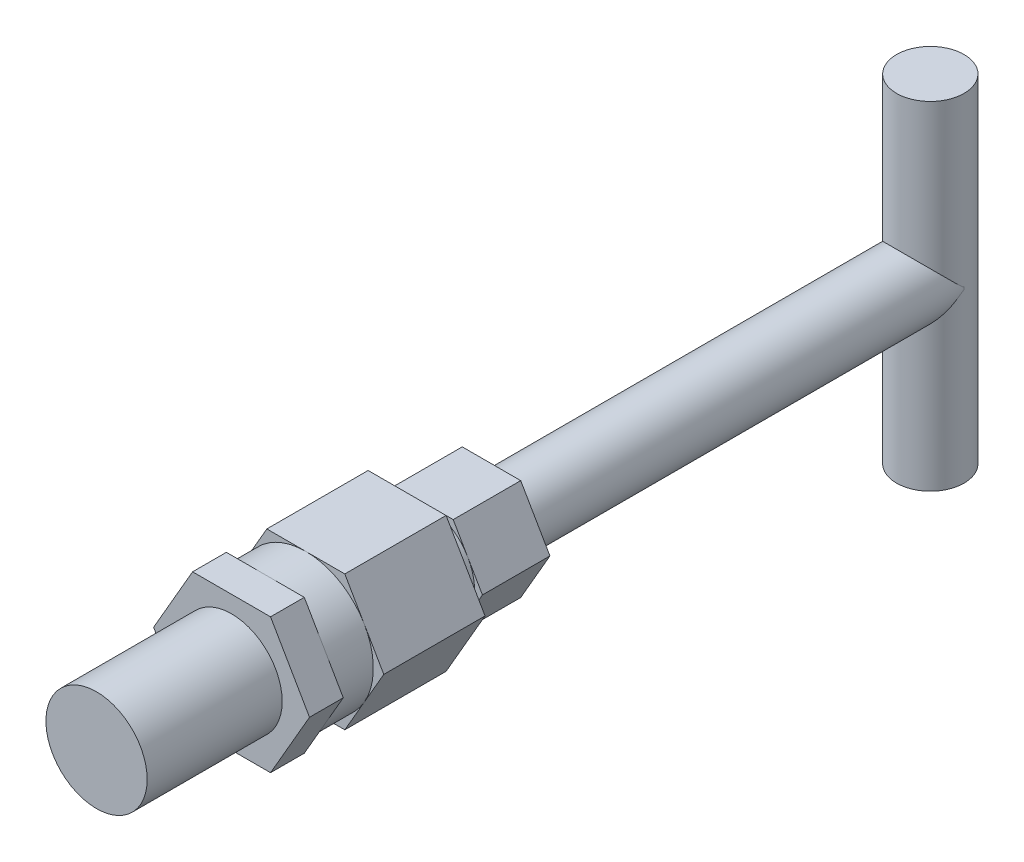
SolidWorks part; units mm, degrees
ref_plane "Front Plane" through (0, 0, 0) normal (0, 0, 1) x (1, 0, 0)
ref_plane "Top Plane" through (0, 0, 0) normal (0, 1, 0) x (1, 0, 0)
ref_plane "Right Plane" through (0, 0, 0) normal (1, 0, 0) x (0, 0, -1)
sketch "Sketch1" plane through (0, 0, 0) normal (0, 0, 1) x (1, 0, 0)
  line L1 (2.3094, 4) -> (-2.3094, 4)
  line L2 (-2.3094, 4) -> (-4.6188, 0)
  line L3 (-4.6188, 0) -> (-2.3094, -4)
  line L4 (-2.3094, -4) -> (2.3094, -4)
  line L5 (2.3094, -4) -> (4.6188, 0)
  line L6 (4.6188, 0) -> (2.3094, 4)
  circle A0 centre (0, 0) radius 4 construction
  dimension "D1" = 8
extrude "Boss-Extrude1" add sketch "Sketch1" along normal mid plane 6
sketch "Sketch2" plane through (0, 0, 3) normal (0, 0, 1) x (1, 0, 0)
  line L0 (4.6188, 0) -> (2.3094, 4) construction
  circle A0 centre (0, 0) radius 4
extrude "Boss-Extrude2" add sketch "Sketch2" along normal blind 2.4
sketch "Sketch3" plane through (0, 0, -3) normal (0, 0, -1) x (-1, 0, 0)
  circle A1 centre (0, 0) radius 3
  dimension "D1" = 6
sketch "Sketch4" plane through (0, 0, 5.4) normal (0, 0, 1) x (1, 0, 0)
  line L0 (2.3094, 4) -> (0, 4) construction
  line L1 (2.3094, 4) -> (-2.3094, 4)
  line L2 (-2.3094, 4) -> (-4.6188, 0)
  line L3 (-4.6188, 0) -> (-2.3094, -4)
  line L4 (-2.3094, -4) -> (2.3094, -4)
  line L5 (2.3094, -4) -> (4.6188, 0)
  line L6 (4.6188, 0) -> (2.3094, 4)
  circle A0 centre (0, 0) radius 4 construction
  dimension "D1" = 8
extrude "Boss-Extrude4" add sketch "Sketch4" along normal blind 2
sketch "Sketch5" plane through (0, 0, 7.4) normal (0, 0, 1) x (1, 0, 0)
  circle A0 centre (0, 0) radius 3
  dimension "D1" = 6
extrude "Boss-Extrude5" add sketch "Sketch5" along normal blind 8
extrude "Boss-Extrude6" add sketch "Sketch3" along normal blind 1 contours A1
sketch "Sketch6" plane through (0, 0, -4) normal (0, 0, -1) x (-1, 0, 0)
  line L0 (-2.3094, 4) -> (2.3094, 4) construction
  line L1 (3.4641, 0) -> (1.7321, 3)
  line L2 (1.7321, 3) -> (-1.7321, 3)
  line L3 (-1.7321, 3) -> (-3.4641, 0)
  line L4 (-3.4641, 0) -> (-1.7321, -3)
  line L5 (-1.7321, -3) -> (1.7321, -3)
  line L6 (1.7321, -3) -> (3.4641, 0)
  circle A0 centre (0, 0) radius 3 construction
  circle A1 centre (0, 0) radius 3 construction
extrude "Boss-Extrude7" add sketch "Sketch6" along normal blind 4
sketch "Sketch7" plane through (0, 0, -8) normal (0, 0, -1) x (-1, 0, 0)
  circle A0 centre (0, 0) radius 2
  dimension "D1" = 4
extrude "Boss-Extrude8" add sketch "Sketch7" along normal blind 26
sketch "Sketch9" plane through (0, 0, 0) normal (0, 1, 0) x (1, 0, 0)
  line L0 (2, 34) -> (-2, 34) construction
  circle A0 centre (0, 34) radius 1.9981
extrude "Boss-Extrude9" add sketch "Sketch9" along normal mid plane 20
